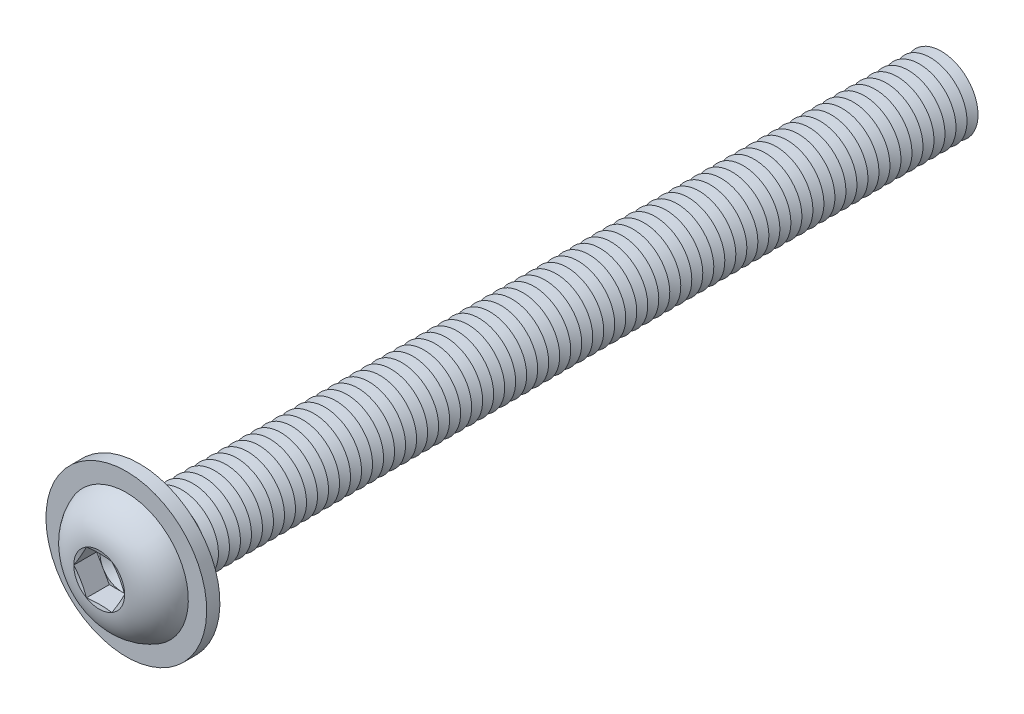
SolidWorks part; units mm, degrees
ref_plane "Front Plane" through (0, 0, 0) normal (0, 0, 1) x (1, 0, 0)
ref_plane "Top Plane" through (0, 0, 0) normal (0, 1, 0) x (1, 0, 0)
ref_plane "Right Plane" through (0, 0, 0) normal (1, 0, 0) x (0, 0, -1)
sketch "Sketch1" plane through (0, 0, 0) normal (1, 0, 0) x (0, 0, -1)
  line L0 (0, 5) -> (0, 8.75)
  line L3 (0, 5) -> (110, 5)
  line L4 (110, 5) -> (110, 0)
  line L5 (110, 0) -> (-5.5, 0) construction
  line L6 (-5.5, 0) -> (110, 0)
  line L7 (-5.5, 3.4641) -> (-5.5, 1.732) construction
  line L8 (-5.5, 1.732) -> (-5.5, 0)
  line L9 (-5.5, 3.4641) -> (-5.0359, 1.732)
  line L10 (-5.0359, 1.732) -> (-5.5, 1.732)
  line L11 (110, 0) -> (22.7481, 0) construction
  line L12 (0, 8.75) -> (-5.5, 8.75) construction
  arc A1 (0, 8.75) -> (-5.5, 3.4641) centre (0, 3.2457) ccw
  point P8 (110, 2.5)
  dimension "D1" = 17.5
  dimension "D2" = 10
  dimension "D3" = 5.5
  dimension "D4" = 6.9282
  dimension "D5" = 110
  dimension "D6" = 15
revolve "Revolve1" add sketch "Sketch1" angle 360 about L5
fillet "Fillet1" radius 0.75 1 edges at (0, 5, 0)
sketch "Sketch2" plane through (0, 0, 0) normal (1, 0, 0) x (0, 0, -1)
  line L0 (109.25, 5) -> (110.75, 5)
  line L1 (110, 5) -> (0.75, 5) construction
  line L2 (110.75, 5) -> (110, 3.701)
  line L3 (110, -5) -> (110, 5) construction
  line L4 (110, 3.701) -> (109.25, 5)
  dimension "D1" = 1.5
revolve "Cut-Revolve1" cut sketch "Sketch2" angle 360 about axis through (0, 0, -110) along (0, 0, -1)
pattern_linear "LPattern1" count 73 spacing 1.5 along (0, 0, 1) of "Cut-Revolve1"
sketch "Sketch3" plane through (0, 0, 5.5) normal (0, 0, 1) x (1, 0, 0)
  line L7 (1.732, 3) -> (-1.7321, 3)
  line L8 (-1.7321, 3) -> (-3.4641, 0)
  line L9 (-3.4641, 0) -> (-1.732, -3)
  line L10 (-1.732, -3) -> (1.732, -3)
  line L11 (1.732, -3) -> (3.4641, 0)
  line L12 (3.4641, 0) -> (1.732, 3)
  circle A0 centre (0, 0) radius 3 construction
  circle A3 centre (0, 0) radius 3.4641 construction
extrude "Cut-Extrude1" cut sketch "Sketch3" against normal blind 3.12
sketch "Sketch4" plane through (0, 0, 2.38) normal (0, 0, 1) x (1, 0, 0)
  line L1 (1.732, 3) -> (-1.7321, 3) construction
  circle A0 centre (0, 0) radius 3
extrude "Cut-Extrude2" cut sketch "Sketch4" against normal through all draft 60
sketch "Sketch5" plane through (0, 0, 0) normal (0, 0, -1) x (-1, 0, 0)
  circle A0 centre (0, 0) radius 10.95
  circle A1 centre (0, 0) radius 5.75
  circle A2 centre (0, 0) radius 5.75 construction
  dimension "D1" = 21.9
extrude "Boss-Extrude1" add sketch "Sketch5" against normal blind 1.8
